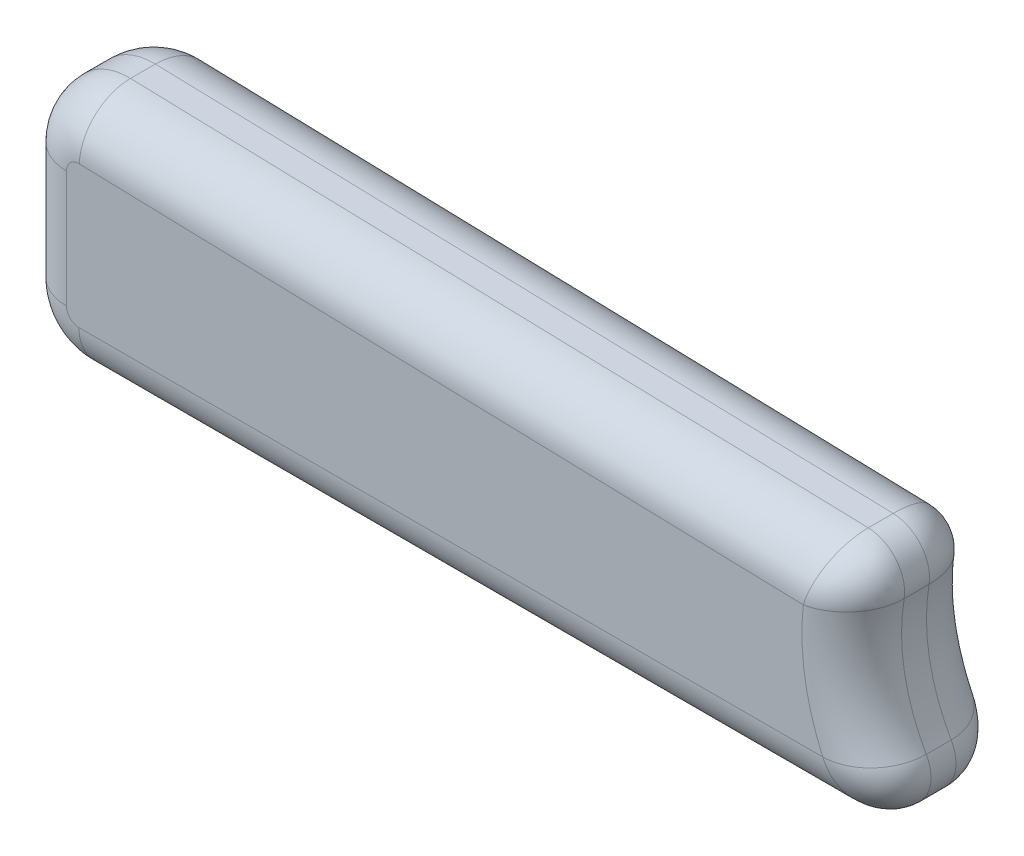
SolidWorks part; units mm, degrees
other "<plastique g>-<Congé5>"
ref_plane "Face" through (0, 0, 0) normal (0, 0, 1) x (1, 0, 0)
ref_plane "Dessus" through (0, 0, 0) normal (0, 1, 0) x (1, 0, 0)
ref_plane "Droite" through (0, 0, 0) normal (1, 0, 0) x (0, 0, -1)
mirrored part "plastique g-"
